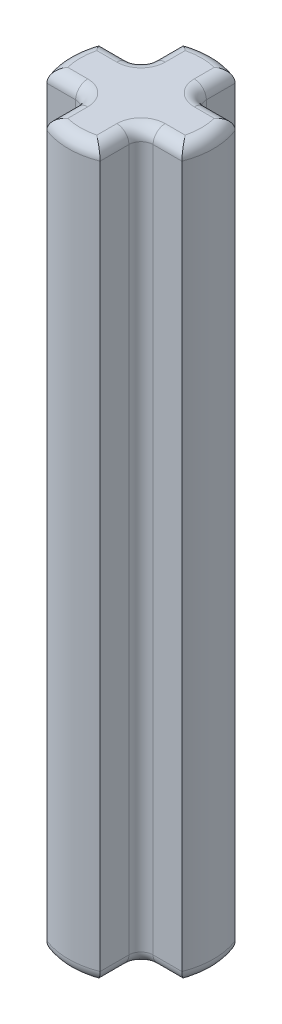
SolidWorks part; units mm, degrees
ref_plane "Front Plane" through (0, 0, 0) normal (0, 0, 1) x (1, 0, 0)
ref_plane "Top Plane" through (0, 0, 0) normal (0, 1, 0) x (1, 0, 0)
ref_plane "Right Plane" through (0, 0, 0) normal (1, 0, 0) x (0, 0, -1)
sketch "Sketch1" plane through (0, 0, 0) normal (0, 1, 0) x (1, 0, 0)
  line L8 (-2.2328, 0.88) -> (-0.88, 0.88)
  line L9 (2.2328, -0.88) -> (0.88, -0.88)
  line L10 (-0.88, 2.2328) -> (-0.88, 0.88)
  line L11 (-0.88, -0.88) -> (-0.88, -2.2328)
  line L12 (0.88, -2.2328) -> (0.88, -0.88)
  line L13 (0.88, 0.88) -> (2.2328, 0.88)
  line L14 (0.88, 0.88) -> (0.88, 2.2328)
  line L15 (-0.88, -0.88) -> (-2.2328, -0.88)
  arc A4 (2.2328, -0.88) -> (2.2328, 0.88) centre (0, 0) ccw
  arc A5 (0.88, 2.2328) -> (-0.88, 2.2328) centre (0, 0) ccw
  arc A6 (-2.2328, 0.88) -> (-2.2328, -0.88) centre (0, 0) ccw
  arc A7 (-0.88, -2.2328) -> (0.88, -2.2328) centre (0, 0) ccw
  dimension "D1" = 0.88
  dimension "D2" = 1.76
  dimension "D3" = 0.88
  dimension "D4" = 1.76
extrude "Boss-Extrude1" add sketch "Sketch1" along normal blind 24
fillet "Fillet7" radius 0.4 28 edges at (-1.5564, 0, -0.88) (-2.4, 0, 0) (-1.5564, 0, 0.88) (-0.88, 0, 1.5564) (0, 0, 2.4) (0.88, 0, 1.5564) (1.5564, 0, 0.88) (2.4, 0, 0) (1.5564, 0, -0.88) (0.88, 0, -1.5564) (0, 0, -2.4) (-0.88, 0, -1.5564) (0, 24, -2.4) (0.88, 24, -1.5564) (1.5564, 24, -0.88) (2.4, 24, 0) (1.5564, 24, 0.88) (0.88, 24, 1.5564) (0, 24, 2.4) (-0.88, 24, 1.5564) (-1.5564, 24, 0.88) (-2.4, 24, 0) (-1.5564, 24, -0.88) (-0.88, 24, -1.5564) (-0.88, 12, -0.88) (0.88, 12, 0.88) (-0.88, 12, 0.88) (0.88, 12, -0.88)
